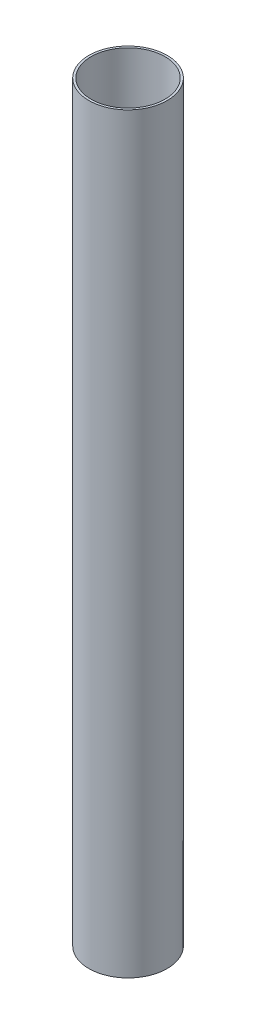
SolidWorks part; units mm, degrees
ref_plane "Front Plane" through (0, 0, 0) normal (0, 0, 1) x (1, 0, 0)
ref_plane "Top Plane" through (0, 0, 0) normal (0, 1, 0) x (1, 0, 0)
ref_plane "Right Plane" through (0, 0, 0) normal (1, 0, 0) x (0, 0, -1)
sketch "Sketch1" plane through (0, 0, 0) normal (0, 1, 0) x (1, 0, 0)
  circle A0 centre (0, 0) radius 14.986
  circle A1 centre (0, 0) radius 15.875
  dimension "D1" = 31.75
  dimension "D2" = 29.972
extrude "Boss-Extrude1" add sketch "Sketch1" along normal blind 304.8
